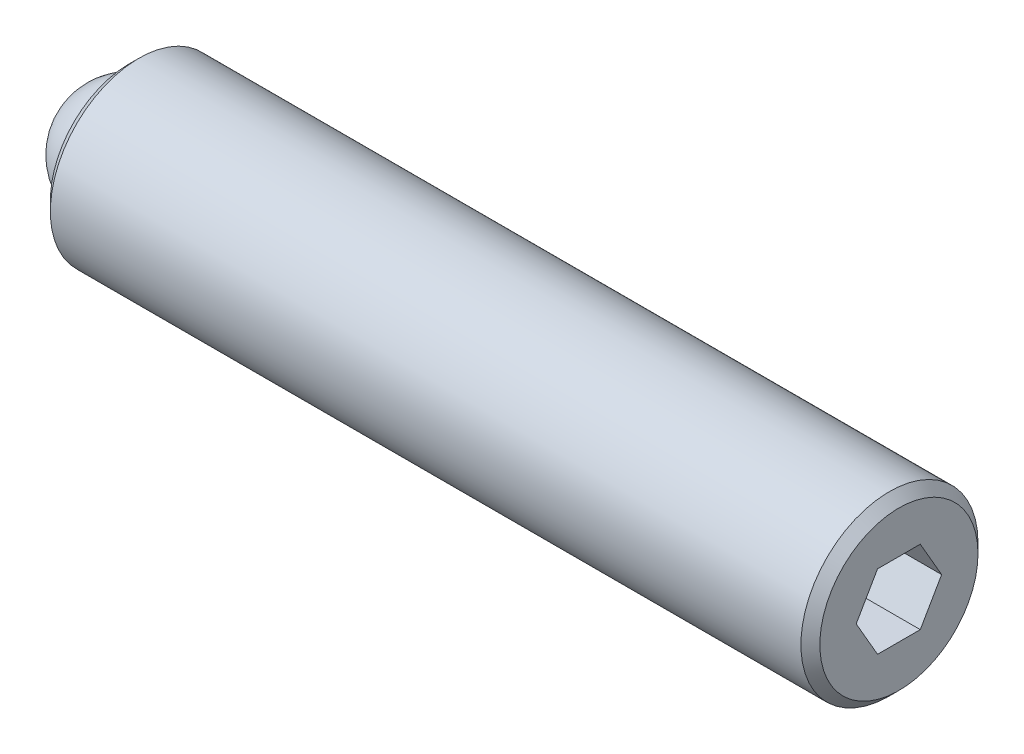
SolidWorks part; units mm, degrees
ref_plane "Front Plane" through (0, 0, 0) normal (0, 0, 1) x (1, 0, 0)
ref_plane "Top Plane" through (0, 0, 0) normal (0, 1, 0) x (1, 0, 0)
ref_plane "Right Plane" through (0, 0, 0) normal (1, 0, 0) x (0, 0, -1)
sketch "Sketch2" plane through (0, 0, 0) normal (1, 0, 0) x (0, 0, -1)
  circle A0 centre (0, 0) radius 2.3749
  dimension "D1" = 4.7498
extrude "Boss-Extrude1" add sketch "Sketch2" along normal blind 20.6375
sketch "Sketch3" plane through (0, 0, 0) normal (-1, 0, 0) x (0, 0, 1)
  circle A0 centre (0, 0) radius 1.5875
  dimension "D1" = 3.175
chamfer "Chamfer1" distance 0.254 angle 45 1 edges at (0, 0, -2.3749)
chamfer "Chamfer2" distance 0.254 angle 45 1 edges at (20.6375, 0, -2.3749)
sketch "Sketch4" plane through (20.6375, 0, 0) normal (1, 0, 0) x (0, 0, -1)
  line L1 (1.1457, 0) -> (0.5728, 0.9922)
  line L2 (0.5728, 0.9922) -> (-0.5728, 0.9922)
  line L3 (-0.5728, 0.9922) -> (-1.1457, 0)
  line L4 (-1.1457, 0) -> (-0.5728, -0.9922)
  line L5 (-0.5728, -0.9922) -> (0.5728, -0.9922)
  line L6 (0.5728, -0.9922) -> (1.1457, 0)
  circle A0 centre (0, 0) radius 0.9922 construction
extrude "Cut-Extrude2" cut sketch "Sketch4" against normal blind 2.286
extrude "Cut-Extrude3" cut sketch "Sketch3" against normal blind 1.5875
sketch "Sketch5" plane through (0, 0, 0) normal (-1, 0, 0) x (0, 0, 1)
  line L0 (0, 0) -> (0, -1.5875)
  line L1 (0, 0) -> (0, 1.5875)
  arc A0 (0, 1.5875) -> (0, -1.5875) centre (0, 0) ccw
revolve "Revolve1" add sketch "Sketch5" angle 360 about L1
